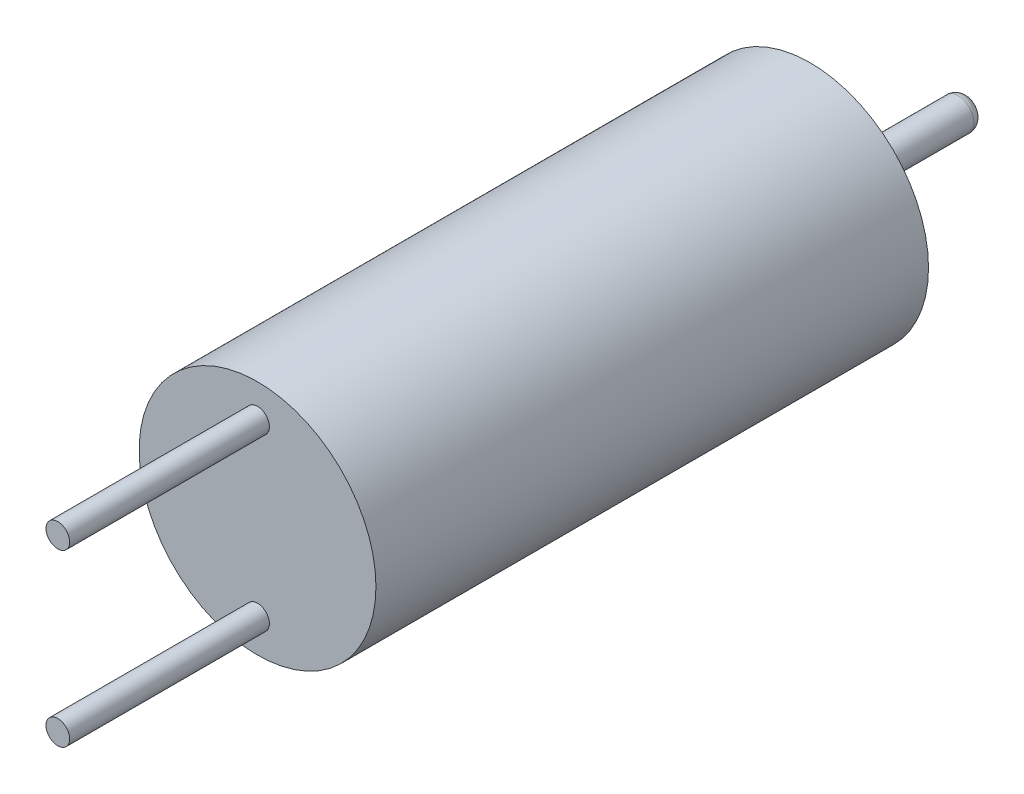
SolidWorks part; units mm, degrees
ref_plane "Plan de face" through (0, 0, 0) normal (0, 0, 1) x (1, 0, 0)
ref_plane "Plan de dessus" through (0, 0, 0) normal (0, 1, 0) x (1, 0, 0)
ref_plane "Plan de droite" through (0, 0, 0) normal (1, 0, 0) x (0, 0, -1)
sketch "Esquisse1" plane through (0, 0, 0) normal (0, 1, 0) x (1, 0, 0)
  line L0 (3, -11.2) -> (0, -11.2)
  line L1 (0, -11.2) -> (0, -25.2)
  line L2 (0, -25.2) -> (3, -25.2)
  line L3 (3, -25.2) -> (3, -11.2)
  line L4 (0, -11.2) -> (0, -25.2) construction
revolve "Révolution1" add sketch "Esquisse1" angle 360 about L4
sketch "Esquisse2" plane through (0, 0, 11.2) normal (0, 0, -1) x (-1, 0, 0)
  circle A0 centre (0, 0) radius 1
extrude "Boss.-Extru.1" add sketch "Esquisse2" along normal blind 0.3
sketch "Esquisse3" plane through (0, 0, 10.9) normal (0, 0, -1) x (-1, 0, 0)
  circle A0 centre (0, 0) radius 0.4
extrude "Boss.-Extru.2" add sketch "Esquisse3" along normal blind 3.7
ref_plane "Plan4" through (0, -2.16, 0) normal (0, 1, 0) x (-1, 0, 0)
sketch "Esquisse4" plane through (0, -2.16, 0) normal (0, 1, 0) x (-1, 0, 0)
  line L0 (-0.3, 25.2) -> (0, 25.2)
  line L1 (0, 25.2) -> (0, 30.26)
  line L2 (0, 30.26) -> (-0.3, 30.26)
  line L3 (-0.3, 30.26) -> (-0.3, 25.2)
  line L4 (0, 25.2) -> (0, 30.26) construction
revolve "Révolution2" add sketch "Esquisse4" angle 360 about L4
ref_plane "Plan5" through (0, 2.16, 0) normal (0, 1, 0) x (-1, 0, 0)
sketch "Esquisse5" plane through (0, 2.16, 0) normal (0, 1, 0) x (-1, 0, 0)
  line L0 (-0.3, 25.2) -> (0, 25.2)
  line L1 (0, 25.2) -> (0, 30.26)
  line L2 (0, 30.26) -> (-0.3, 30.26)
  line L3 (-0.3, 30.26) -> (-0.3, 25.2)
  line L4 (0, 25.2) -> (0, 30.26) construction
revolve "Révolution3" add sketch "Esquisse5" angle 360 about L4
fillet "Congé1" radius 0.25 1 edges at (-0.4, 0, 7.2)
